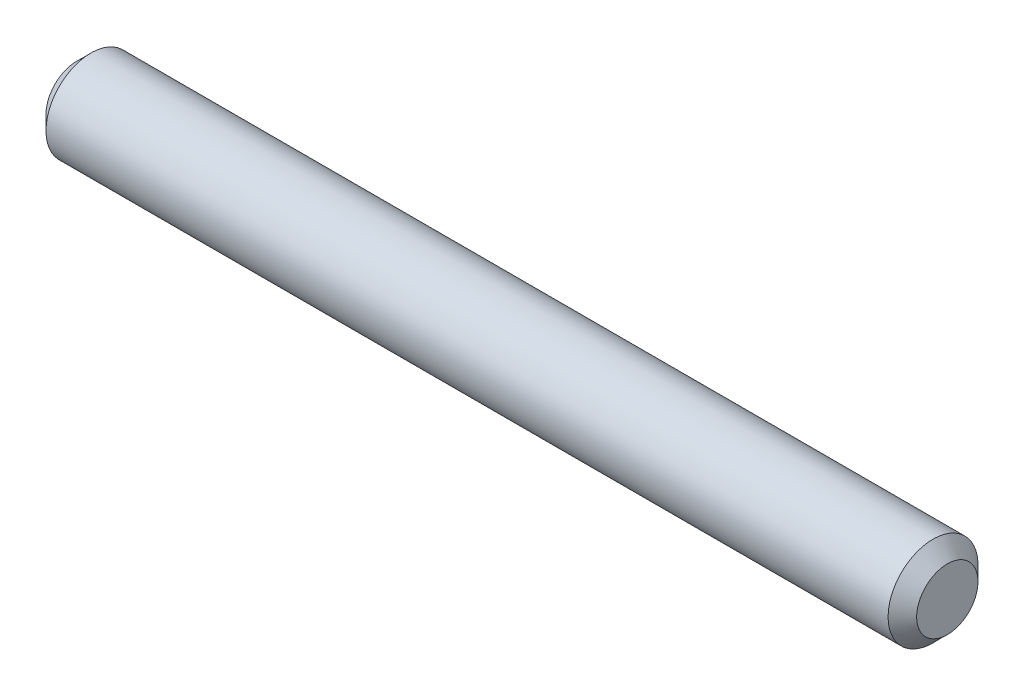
SolidWorks part; units mm, degrees
ref_plane "Front Plane" through (0, 0, 0) normal (0, 0, 1) x (1, 0, 0)
ref_plane "Top Plane" through (0, 0, 0) normal (0, 1, 0) x (1, 0, 0)
ref_plane "Right Plane" through (0, 0, 0) normal (1, 0, 0) x (0, 0, -1)
sketch "Sketch1" plane through (0, 0, 0) normal (0, 0, 1) x (1, 0, 0)
  line L0 (0, 0) -> (50000, 0) construction
  line L1 (0, 0) -> (0, 0.5461)
  line L2 (0.254, 0.8001) -> (15.24, 0.8001)
  line L3 (15.494, 0.5461) -> (15.494, 0)
  line L4 (0, 0) -> (15.494, 0)
  line L5 (0, 0.5461) -> (0.254, 0.8001)
  line L6 (15.24, 0.8001) -> (15.494, 0.5461)
  point P4 (0, 0.8001)
  point P6 (15.494, 0.8001)
  dimension "D1" = 15.494
  dimension "D2" = 0.8001
  dimension "D3" = 0.254
  dimension "D4" = 45
  dimension "D5" = 0.254
  dimension "D6" = 45
revolve "Revolve1" add sketch "Sketch1" angle 360 about L0
